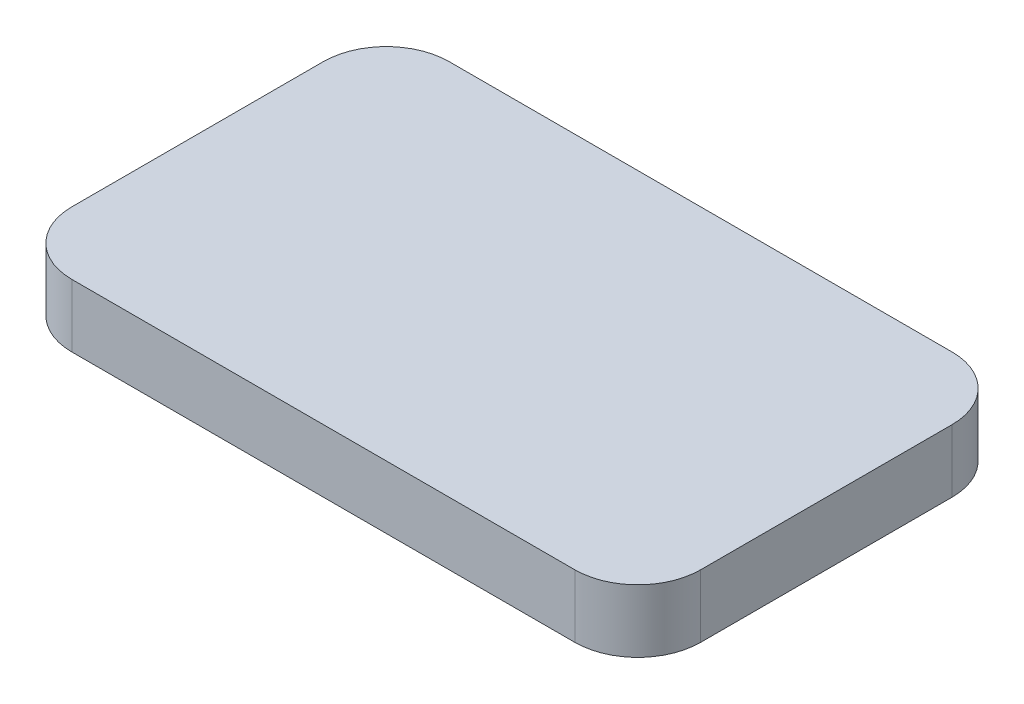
SolidWorks part; units mm, degrees
ref_plane "Front Plane" through (0, 0, 0) normal (0, 0, 1) x (1, 0, 0)
ref_plane "Top Plane" through (0, 0, 0) normal (0, 1, 0) x (1, 0, 0)
ref_plane "Right Plane" through (0, 0, 0) normal (1, 0, 0) x (0, 0, -1)
sketch "Sketch1" plane through (0, 0, 0) normal (0, 1, 0) x (1, 0, 0)
  line L1 (50, -30) -> (-50, -30)
  line L2 (50, -30) -> (50, 30)
  line L3 (50, 30) -> (-50, 30)
  line L4 (-50, -30) -> (-50, 30)
  line L5 (50, -30) -> (-50, 30) construction
  line L6 (50, 30) -> (-50, -30) construction
  point P0 (0, 0)
  dimension "D1" = 100
  dimension "D2" = 60
extrude "Boss-Extrude1" add sketch "Sketch1" along normal blind 10
fillet "Fillet1" radius 10 4 edges at (-50, 5, -30) (50, 5, -30) (50, 5, 30) (-50, 5, 30)
